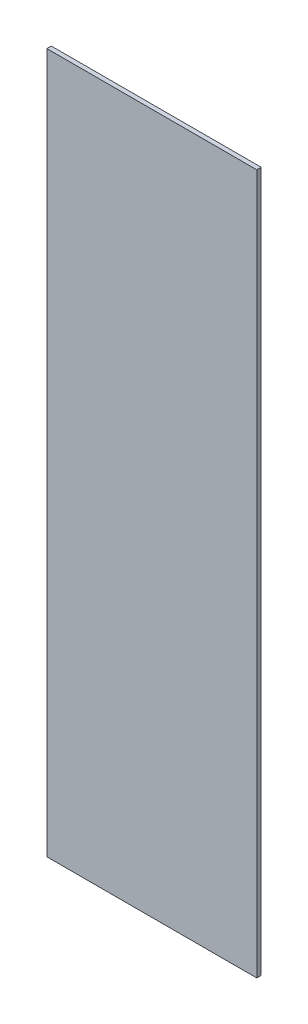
SolidWorks part; units mm, degrees
ref_plane "Front Plane" through (0, 0, 0) normal (0, 0, 1) x (1, 0, 0)
ref_plane "Top Plane" through (0, 0, 0) normal (0, 1, 0) x (1, 0, 0)
ref_plane "Right Plane" through (0, 0, 0) normal (1, 0, 0) x (0, 0, -1)
sketch "Sketch1" plane through (0, 0, 0) normal (0, 0, 1) x (1, 0, 0)
  line L1 (-38.1, -127) -> (38.1, -127)
  line L2 (-38.1, -127) -> (-38.1, 127)
  line L3 (-38.1, 127) -> (38.1, 127)
  line L4 (38.1, -127) -> (38.1, 127)
  line L5 (-38.1, -127) -> (38.1, 127) construction
  line L6 (-38.1, 127) -> (38.1, -127) construction
  point P0 (0, 0)
  dimension "D1" = 76.2
  dimension "D2" = 254
extrude "Boss-Extrude1" add sketch "Sketch1" along normal blind 1.6002
